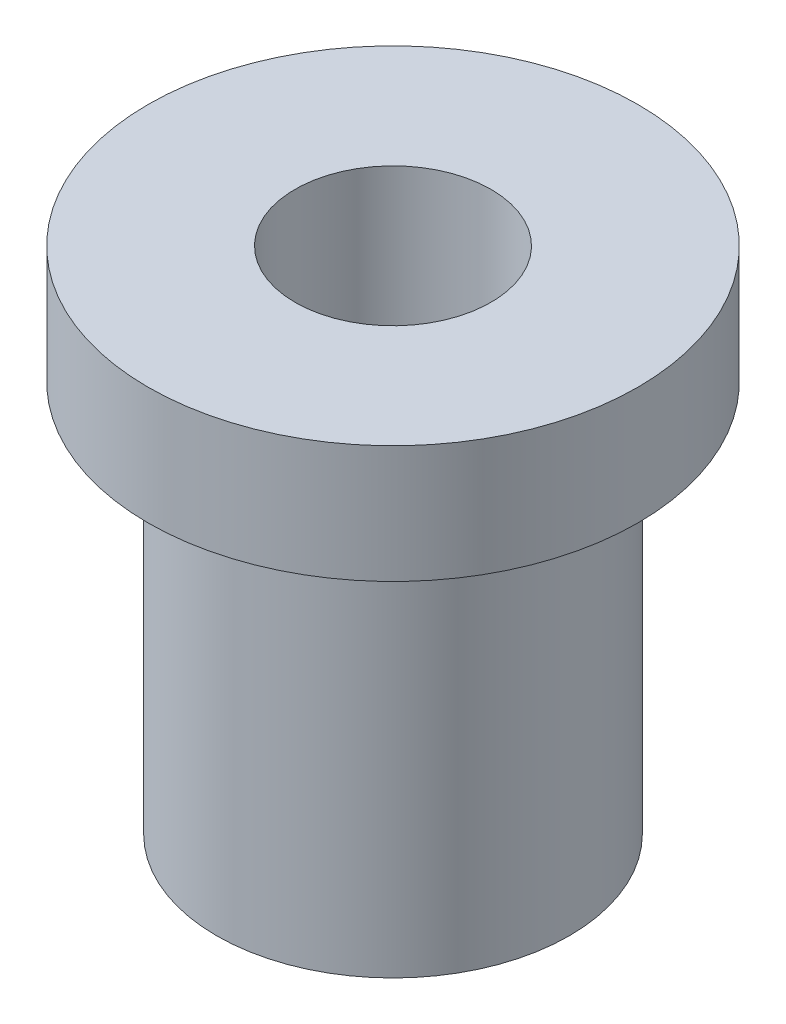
SolidWorks part; units mm, degrees
ref_plane "Płaszczyzna przednia" through (0, 0, 0) normal (0, 0, 1) x (1, 0, 0)
ref_plane "Płaszczyzna górna" through (0, 0, 0) normal (0, 1, 0) x (1, 0, 0)
ref_plane "Płaszczyzna prawa" through (0, 0, 0) normal (1, 0, 0) x (0, 0, -1)
sketch "Szkic1" plane through (0, 0, 0) normal (0, 0, 1) x (1, 0, 0)
  line L0 (5, 0) -> (5, 26)
  line L1 (5, 26) -> (12.5, 26)
  line L2 (12.5, 26) -> (12.5, 20)
  line L3 (12.5, 20) -> (9, 20)
  line L4 (9, 20) -> (9, 0)
  line L5 (9, 0) -> (5, 0)
  line L6 (0, 0) -> (0, 26) construction
  dimension "D1" = 25
  dimension "D2" = 18
  dimension "D3" = 10
  dimension "D4" = 20
  dimension "D5" = 26
revolve "Obrót1" add sketch "Szkic1" angle 360 about L6
